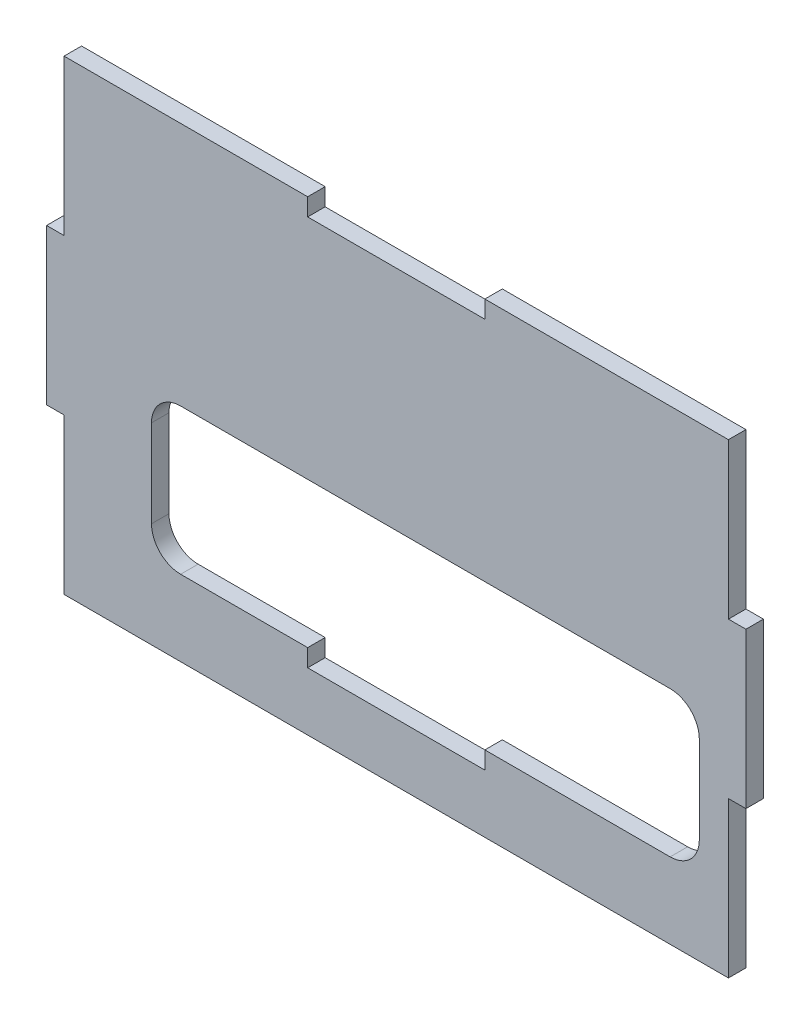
SolidWorks part; units mm, degrees
ref_plane "Front Plane" through (0, 0, 0) normal (0, 0, 1) x (1, 0, 0)
ref_plane "Top Plane" through (0, 0, 0) normal (0, 1, 0) x (1, 0, 0)
ref_plane "Right Plane" through (0, 0, 0) normal (1, 0, 0) x (0, 0, -1)
sketch "Sketch1" plane through (0, 0, 0) normal (0, 0, 1) x (1, 0, 0)
  line L1 (-60, -40) -> (60, -40)
  line L2 (-60, -40) -> (-60, 40)
  line L3 (-60, 40) -> (60, 40)
  line L4 (60, -40) -> (60, 40)
  line L5 (-60, -40) -> (60, 40) construction
  line L6 (-60, 40) -> (60, -40) construction
  point P0 (0, 0)
  dimension "D1" = 120
  dimension "D2" = 80
extrude "Boss-Extrude1" add sketch "Sketch1" along normal blind 3
sketch "Sketch2" plane through (0, 0, 3) normal (0, 0, 1) x (1, 0, 0)
  line L0 (-60, -30) -> (60, -30)
  line L1 (-60, -30) -> (-60, -27)
  line L2 (60, -30) -> (60, -27)
  line L3 (-60, -27) -> (60, -27)
  line L4 (-60, 40) -> (-60, -40) construction
  line L5 (60, -40) -> (60, 40) construction
  line L6 (-60, -40) -> (60, -40) construction
  line L7 (-15.2, -27) -> (-15.2, -30)
  line L8 (-15.2, -27) -> (15.2, -27)
  line L9 (-15.2, -30) -> (15.2, -30)
  line L10 (15.2, -27) -> (15.2, -30)
  line L11 (-15, -30) -> (-15, -27) construction
  line L12 (15, -30) -> (15, -27) construction
  dimension "D1" = 10
  dimension "D2" = 3
  dimension "D3" = 0.2
  dimension "D4" = 0.2
extrude "Cut-Extrude1" cut sketch "Sketch2" against normal blind 3 contours L10 L3 L7 L0
sketch "Sketch3" plane through (0, 0, 3) normal (0, 0, 1) x (1, 0, 0)
  line L0 (-60, -40) -> (60, -40) construction
  line L1 (-60, 40) -> (-57, 40)
  line L2 (-60, 40) -> (-60, 13.3333)
  line L3 (-60, 13.3333) -> (-57, 13.3333)
  line L4 (-57, 40) -> (-57, 13.3333)
  line L5 (-60, 13.3333) -> (-57, 13.3333)
  line L6 (-60, 13.3333) -> (-60, -13.3333)
  line L7 (-60, -13.3333) -> (-57, -13.3333)
  line L8 (-57, 13.3333) -> (-57, -13.3333)
  line L9 (-60, -13.3333) -> (-57, -13.3333)
  line L10 (-60, -13.3333) -> (-60, -40)
  line L11 (-60, -40) -> (-57, -40)
  line L12 (-57, -13.3333) -> (-57, -40)
  dimension "D1" = 3
extrude "Cut-Extrude2" cut sketch "Sketch3" against normal blind 3 contours L4 L3 M14 M15 | L12 L7 M15 M16
mirror "Mirror1" about plane through (0, 0, 0) normal (1, 0, 0) of "Cut-Extrude2"
sketch "Sketch4" plane through (0, 0, 3) normal (0, 0, 1) x (1, 0, 0)
  line L0 (-15.2, -27) -> (15.2, -27) construction
  line L1 (-42, -27) -> (52, -27)
  line L2 (-42, -27) -> (-42, -2)
  line L3 (-42, -2) -> (52, -2)
  line L4 (52, -27) -> (52, -2)
  line L5 (-57, -13.3333) -> (-57, -40) construction
  line L6 (57, -13.3333) -> (57, -40) construction
  dimension "D1" = 15
  dimension "D2" = 5
  dimension "D3" = 25
extrude "Cut-Extrude3" cut sketch "Sketch4" against normal blind 3
fillet "Fillet1" radius 5 4 edges at (-42, -27, 1.5) (-42, -2, 1.5) (52, -2, 1.5) (52, -27, 1.5)
pattern_linear "LPattern1" count 2 spacing 67 along (0, 1, 0) of "Cut-Extrude1"
